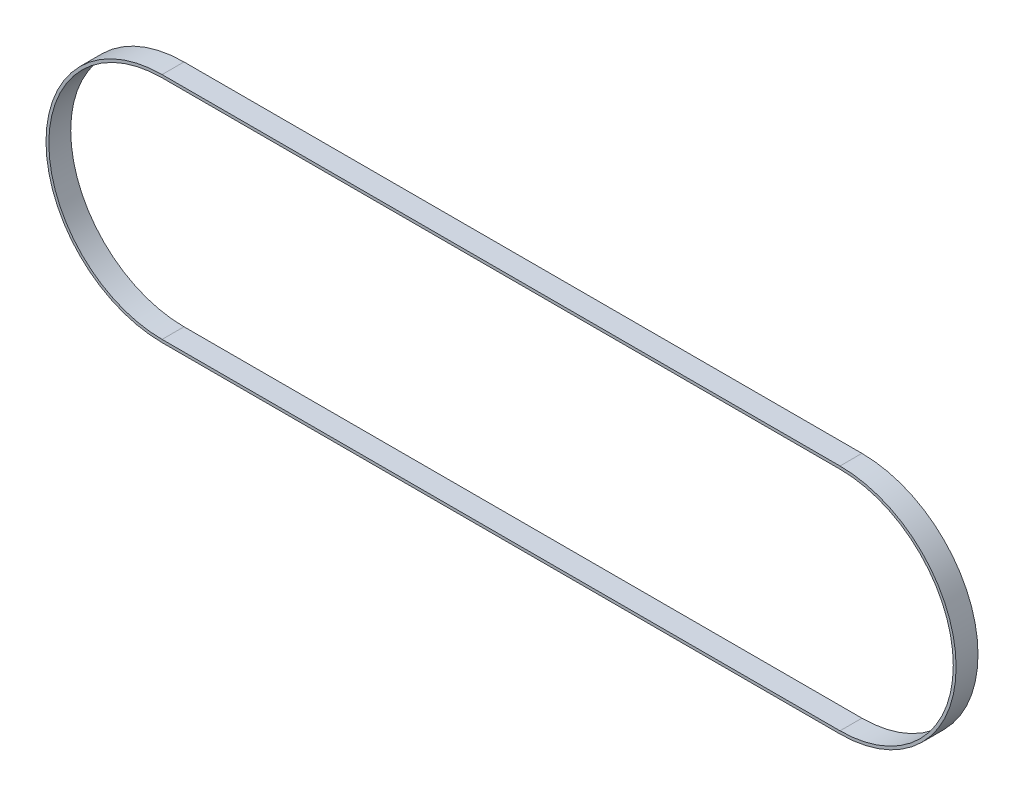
SolidWorks part; units mm, degrees
ref_plane "Ebene vorne" through (0, 0, 0) normal (0, 0, 1) x (1, 0, 0)
ref_plane "Ebene oben" through (0, 0, 0) normal (0, 1, 0) x (1, 0, 0)
ref_plane "Ebene rechts" through (0, 0, 0) normal (1, 0, 0) x (0, 0, -1)
sketch "Skizze2" plane through (0, 0, 0) normal (0, 0, 1) x (1, 0, 0)
  line L0 (0, 0) -> (1, 0) construction
  line L1 (0, 0) -> (0, 1) construction
  line L2 (0, 40.595) -> (240, 40.595)
  line L3 (240, -40.595) -> (0, -40.595)
  arc A0 (0, -40.595) -> (0, 40.595) centre (0, 0) cw
  arc A1 (240, 40.595) -> (240, -40.595) centre (240, 0) cw
extrude "Linear-Austragen-Dünn1" add sketch "Skizze2" along normal mid plane 7.75 thin
